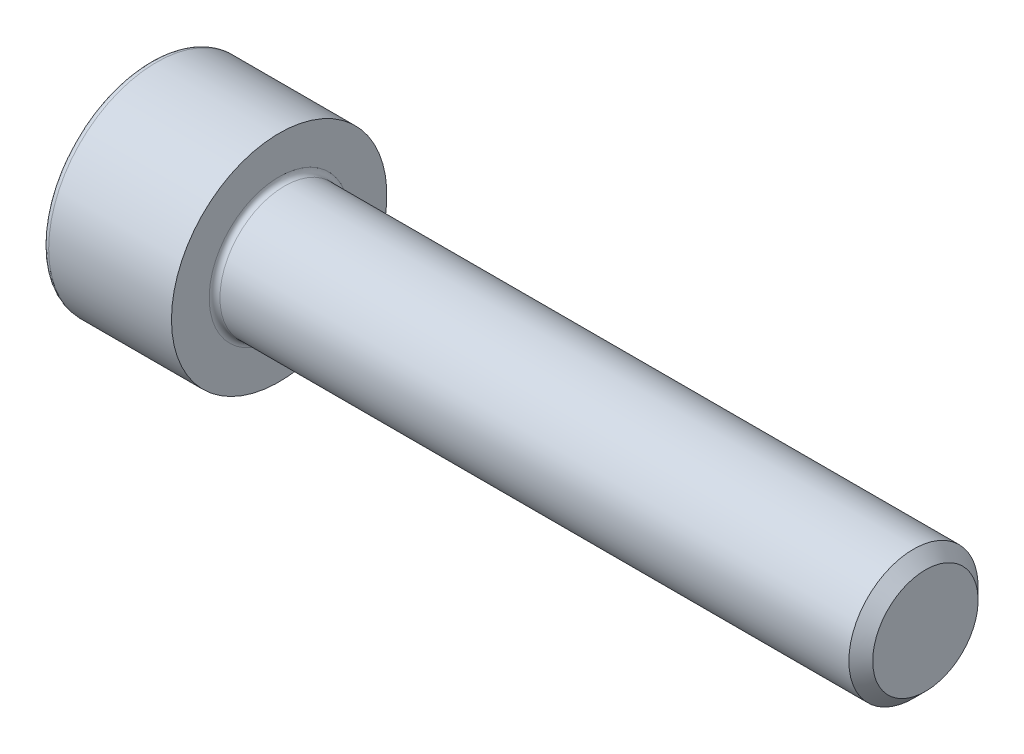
SolidWorks part; units mm, degrees
ref_plane "Plane1" through (0, 0, 0) normal (0, 0, 1) x (1, 0, 0)
ref_plane "Plane2" through (0, 0, 0) normal (0, 1, 0) x (1, 0, 0)
ref_plane "Plane3" through (0, 0, 0) normal (1, 0, 0) x (0, 0, -1)
revolve "Base-Revolve" add sketch "BodySke"
sketch "BodySke" plane through (0, 0, 0) normal (0, 0, 1) x (1, 0, 0)
  line L0 (0, 0) -> (0, 5)
  line L1 (0, 5) -> (6, 5)
  line L2 (6, 5) -> (6, 3)
  line L3 (6, 3) -> (35.4455, 3)
  line L4 (36, 2.4455) -> (36, 0)
  line L5 (36, 0) -> (0, 0)
  line L6 (-31.75, 0) -> (127, 0) construction
  line L8 (36, 2.4455) -> (35.4455, 3)
  line L10 (36, -2.4455) -> (35.4455, -3) construction
  line L11 (7, 9.525) -> (7, 3.175) construction
  line L12 (6, 9.525) -> (6, 3.175) construction
  line L13 (-24, 9.525) -> (-24, 3.175) construction
  dimension "Diameter" = 6
  dimension "Head_ht" = 6
  dimension "Length" = 30
  dimension "Body_ch_ang" = 45
  dimension "Head_dia" = 10
  dimension "Minor_dia" = 4.891
  dimension "Advance" = 1
  dimension "Thread_nom" = 30
  dimension "Thread_length" = 60
fillet "Fillet1" radius 0.25 1 edges at (6, 0, 3)
fillet "Fillet2" radius 0.3 1 edges at (0, 0, 5)
sketch "Sketch2" plane through (0, 0, 0) normal (0, 0, 1) x (1, 0, 0)
  line L0 (0, 2.542) -> (3, 2.542)
  line L1 (3, 2.542) -> (4.4676, 0)
  line L2 (-31.75, 0) -> (127, 0) construction
  line L3 (4.4676, 0) -> (0, 0)
  line L4 (0, 0) -> (0, 2.542)
  line L6 (0, 0) -> (47.625, 0) construction
  dimension "D1" = 2.542
  dimension "D2" = 60
  dimension "Depth" = 3
revolve "Hex-PreBroach" cut sketch "Sketch2" angle 360 about L6
sketch "Sketch3" plane through (0, 0, 0) normal (-1, 0, 0) x (0, 0.5, 0.866)
  line L0 (1.4676, 2.542) -> (-1.4676, 2.542)
  line L1 (-1.4676, 2.542) -> (-2.9352, 0)
  line L2 (1.4676, 2.542) -> (2.9352, 0)
  line L3 (1.4676, -2.542) -> (2.9352, 0)
  line L4 (1.4676, -2.542) -> (-1.4676, -2.542)
  line L5 (-1.4676, -2.542) -> (-2.9352, 0)
  dimension "D1" = 2.542
  dimension "D2" = 2.542
  dimension "Hex_size" = 5.084
extrude "Hex" cut sketch "Sketch3" against normal blind 3
sketch "ThdSchSke" plane through (0, 0, 0) normal (0, 0, 1) x (1, 0, 0)
  line L0 (9, -2.4455) -> (8.6117, -3)
  line L1 (9, -2.4455) -> (9.3883, -3)
  line L2 (9.3883, -3) -> (9.3883, -3.75)
  line L3 (-3.175, 0) -> (5.1513, 0) construction
  line L4 (0, 4.7) -> (0, -4.7) construction
  line L5 (9.3883, -3.75) -> (8.6117, -3.75)
  line L6 (8.6117, -3.75) -> (8.6117, -3)
  dimension "Thread_minor" = 4.891
  dimension "Diameter" = 6
  dimension "Start" = 9
  dimension "SideAngle" = 55
  dimension "VeeAngle" = 70
  dimension "Overcut" = 7.5
revolve "ThreadSchematic" [suppressed] cut sketch "ThdSchSke" angle 360 about L3
pattern_linear "ThdSchPat" [suppressed]
equation "\"D2@Sketch3\" = \"Hex_size@Sketch3\" / 2"
equation "\"D1@Sketch3\" = \"Hex_size@Sketch3\" / 2"
equation "\"D1@Sketch2\" = \"Hex_size@Sketch3\" / 2"
equation "\"Thread_minor@ThreadCosmetic\"  =  \"Minor_dia@BodySke\""
equation "\"Depth@Sketch2\" =  \"Key_eng@Hex\""
equation "\"Thread_length@ThreadCosmetic\" = ((sgn( (\"Length@BodySke\" - \"Advance@BodySke\" * 3.0) - \"Thread_nom@BodySke\" )-1)*( (\"Length@BodySke\" - \"Advance@BodySke\" * 3.0) - \"Thread_nom@BodySke\" ))/-2+ \"Thread_no"
equation "\"Thread_minor@ThdSchSke\" = \"Minor_dia@BodySke\""
equation "\"Diameter@ThdSchSke\" = \"Diameter@BodySke\""
equation "\"Overcut@ThdSchSke\" = \"Diameter@BodySke\" * 1.25"
equation "\"Start@ThdSchSke\" = \"Head_ht@BodySke\" + \"Length@BodySke\" - \"Thread_length@ThreadCosmetic\"  '---Non-countersunk---"
equation "\"Num_threads@ThdSchPat\" = int( \"Thread_length@ThreadCosmetic\" / \"Advance@BodySke\" + 0.999 )  + 1"
equation "\"Advance@ThdSchPat\" = \"Thread_length@ThreadCosmetic\" /  (\"Num_threads@ThdSchPat\" - 1) 'relax it"
equation "\"Num_threads@ThdSchPat\" = \"Num_threads@ThdSchPat\" - sgn( \"Num_threads@ThdSchPat\" - 1) '---chamfered tips only---"
